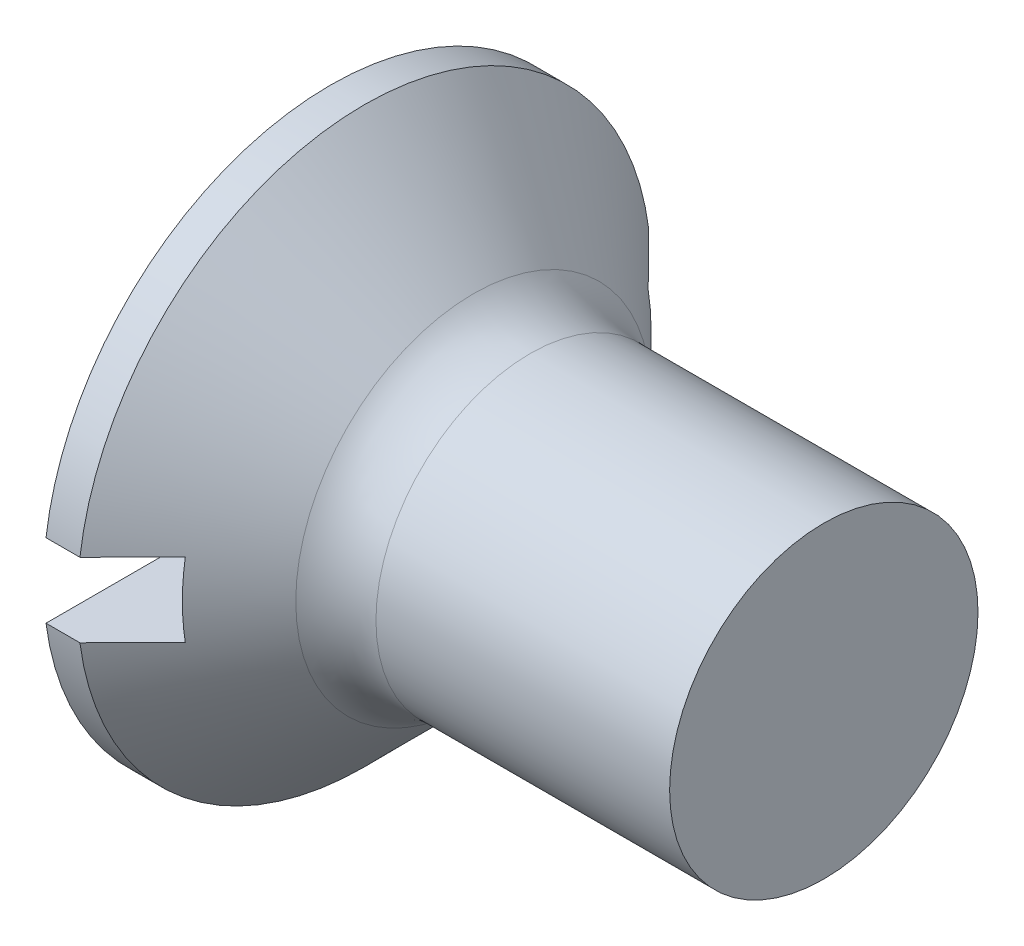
SolidWorks part; units mm, degrees
ref_plane "Plane1" through (0, 0, 0) normal (0, 0, 1) x (1, 0, 0)
ref_plane "Plane2" through (0, 0, 0) normal (0, 1, 0) x (1, 0, 0)
ref_plane "Plane3" through (0, 0, 0) normal (1, 0, 0) x (0, 0, -1)
sketch "BodySke" plane through (0, 0, 0) normal (0, 0, 1) x (1, 0, 0)
  line L0 (0, 0) -> (0, 4.65)
  line L1 (0, 4.65) -> (0.55, 4.65)
  line L2 (2.7, 2.5) -> (8, 2.5)
  line L3 (8, 2.5) -> (8, 0)
  line L4 (8, 0) -> (0, 0)
  line L5 (-6.35, 0) -> (82.55, 0) construction
  line L6 (2.7, -2.5) -> (8, -2.5) construction
  line L7 (0.55, -4.65) -> (2.7, -2.5) construction
  line L8 (0.55, 4.65) -> (2.7, 2.5)
  line L9 (0, -4.65) -> (0.55, -4.65) construction
  line L10 (3.5, 4.0875) -> (3.5, -5.4375) construction
  line L11 (0, 6.35) -> (0, -3.175) construction
  dimension "Diameter" = 5
  dimension "Length" = 8
  dimension "Head_ht" = 2.7
  dimension "Head_dia" = 9.3
  dimension "Head_ang" = 90
  dimension "D6" = 0.55
  dimension "Advance" = 0.8
  dimension "Thread_nom" = 8
revolve "Base-Revolve" add sketch "BodySke" angle 360 about L5
fillet "Fillet1" radius 1.3 1 edges at (2.7, 0, 2.5)
sketch "Sketch2" plane through (0, 0, 0) normal (-1, 0, 0) x (0, 0, 1)
  line L0 (-4.65, -0.6) -> (4.65, -0.6)
  line L1 (-4.65, -0.6) -> (-4.65, 0.6)
  line L2 (4.65, 0.6) -> (-4.65, 0.6)
  line L3 (4.65, 0.6) -> (4.65, -0.6)
  dimension "D1" = 0.6
  dimension "Slot_width" = 1.2
  dimension "D2" = 9.3
  dimension "D3" = 4.65
extrude "Slot" cut sketch "Sketch2" against normal blind 1.4
sketch "ThdSchSke" plane through (0, 0, 0) normal (0, 0, 1) x (1, 0, 0)
  line L0 (3.5, -2.055) -> (3.1884, -2.5)
  line L1 (3.5, -2.055) -> (3.8116, -2.5)
  line L2 (3.8116, -2.5) -> (3.8116, -3.125)
  line L3 (-3.175, 0) -> (5.1513, 0) construction
  line L5 (3.8116, -3.125) -> (3.1884, -3.125)
  line L6 (3.1884, -3.125) -> (3.1884, -2.5)
  line L7 (0, 4.65) -> (0, 0.6) construction
  dimension "Thread_minor" = 4.11
  dimension "Diameter" = 5
  dimension "Start" = 3.5
  dimension "SideAngle" = 55
  dimension "VeeAngle" = 70
  dimension "Overcut" = 6.25
revolve "ThreadSchematic" [suppressed] cut sketch "ThdSchSke" angle 360 about L3
pattern_linear "ThdSchPat" [suppressed]
equation "\"D1@Sketch2\" = \"Slot_width@Sketch2\" / 2"
equation "\"D2@Sketch2\" = \"Head_dia@BodySke\""
equation "\"D3@Sketch2\" = \"D2@Sketch2\" / 2"
equation "\"Thread_length@ThreadCosmetic\" = ((sgn( (\"Length@BodySke\" - \"Advance@BodySke\" * 1.0 - \"Head_ht@BodySke\" ) - \"Thread_nom@BodySke\" )-1)*( (\"Length@BodySke\" - \"Advance@BodySke\" * 1.0 - \"Head_ht@BodySke\" "
equation "\"Thread_minor@ThdSchSke\" = \"Thread_minor@ThreadCosmetic\""
equation "\"Diameter@ThdSchSke\" = \"Diameter@BodySke\""
equation "\"Overcut@ThdSchSke\" = \"Diameter@BodySke\" * 1.25"
equation "\"Start@ThdSchSke\" = 0.000001 + \"Length@BodySke\" - \"Thread_length@ThreadCosmetic\"  '---Countersunk---"
equation "\"Num_threads@ThdSchPat\" = int( \"Thread_length@ThreadCosmetic\" / \"Advance@BodySke\" + 0.999 )  + 1"
equation "\"Advance@ThdSchPat\" = \"Thread_length@ThreadCosmetic\" /  (\"Num_threads@ThdSchPat\" - 1) 'relax it"
